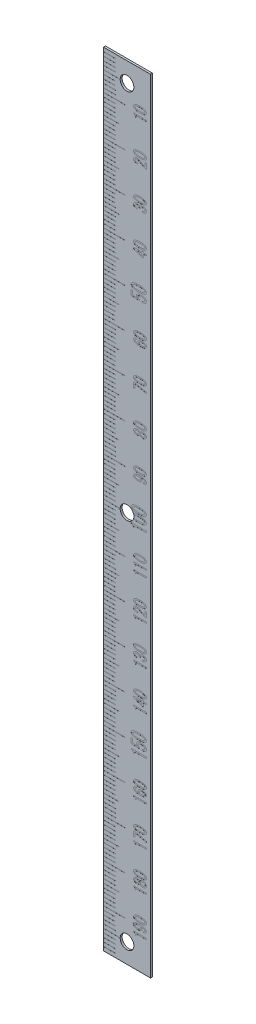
SolidWorks part; units mm, degrees
ref_plane "Front" through (0, 0, 0) normal (0, 0, 1) x (1, 0, 0)
ref_plane "Top" through (0, 0, 0) normal (0, 1, 0) x (1, 0, 0)
ref_plane "Right" through (0, 0, 0) normal (1, 0, 0) x (0, 0, -1)
sketch "Sketch1" plane through (0, 0, 0) normal (0, 0, 1) x (1, 0, 0)
  line L1 (0, 0) -> (0, 200)
  line L2 (0, 0) -> (12, 0)
  line L3 (12, 0) -> (12, 200)
  line L4 (0, 200) -> (12, 200)
  dimension "D1" = 200
  dimension "D2" = 12
extrude "Extrude1" add sketch "Sketch1" along normal blind 0.5
sketch "Sketch2" plane through (0, 0, 0.5) normal (0, 0, 1) x (1, 0, 0)
  line L0 (0, 200) -> (0, 0) construction
  line L1 (0, 0) -> (12, 0) construction
  line L2 (12, 200) -> (0, 200) construction
  circle A0 centre (6, 5) radius 1.75
  circle A1 centre (6, 195) radius 1.75
  circle A4 centre (6, 100) radius 1.75
  dimension "D1" = 6
  dimension "D2" = 6
  dimension "D3" = 5
  dimension "D4" = 5
  dimension "D5" = 3.5
  dimension "D6" = 3.5
  dimension "D8" = 2
extrude "Extrude2" cut sketch "Sketch2" against normal through all
sketch "Sketch3" plane through (0, 0, 0.5) normal (0, 0, 1) x (1, 0, 0)
  line L0 (12, 200) -> (0, 200) construction
  line L1 (7.5, 188.25) -> (11, 188.25) construction
  line L2 (7.5, 188.25) -> (7.5, 191.75) construction
  line L3 (7.5, 191.75) -> (11, 191.75) construction
  line L4 (11, 188.25) -> (11, 191.75) construction
  line L6 (11, 178.25) -> (11, 181.75) construction
  line L7 (11, 168.25) -> (11, 171.75) construction
  line L8 (11, 158.25) -> (11, 161.75) construction
  line L9 (11, 148.25) -> (11, 151.75) construction
  line L10 (11, 138.25) -> (11, 141.75) construction
  line L11 (11, 128.25) -> (11, 131.75) construction
  line L12 (11, 118.25) -> (11, 121.75) construction
  line L13 (11, 108.25) -> (11, 111.75) construction
  line L14 (11, 47.2) -> (11, 52.8) construction
  line L15 (11, 37.2) -> (11, 42.8) construction
  line L16 (11, 98.25) -> (11, 101.75) construction
  line L17 (11, 50) -> (-4.9003, 50) construction
  line L18 (11, 27.2) -> (11, 32.8) construction
  line L19 (11, 17.2) -> (11, 22.8) construction
  line L20 (11, 7.2) -> (11, 12.8) construction
  line L21 (11, 97.2) -> (11, 102.8) construction
  line L22 (12, 0) -> (12, 200) construction
  line L23 (11, 87.2) -> (11, 92.8) construction
  line L24 (11, 57.2) -> (11, 62.8) construction
  line L25 (11, 67.2) -> (11, 72.8) construction
  line L26 (11, 77.2) -> (11, 82.8) construction
  text T0 "10" font "ＭＳ ゴシック" height in points 11
  text T1 "20" font "ＭＳ ゴシック" height in points 11
  text T2 "30" font "ＭＳ ゴシック" height in points 11
  text T3 "40" font "ＭＳ ゴシック" height in points 11
  text T4 "50" font "ＭＳ ゴシック" height in points 13
  text T5 "60  " font "ＭＳ ゴシック" height in points 11
  text T6 "70" font "ＭＳ ゴシック" height in points 11
  text T7 "80" font "ＭＳ ゴシック" height in points 11
  text T8 "90" font "ＭＳ ゴシック" height in points 11
  text T9 "150" font "ＭＳ ゴシック" height in points 13
  text T10 "160" font "ＭＳ ゴシック" height in points 11
  text T11 "170" font "ＭＳ ゴシック" height in points 11
  text T12 "180" font "ＭＳ ゴシック" height in points 11
  text T13 "190" font "ＭＳ ゴシック" height in points 11
  text T14 "100" font "ＭＳ ゴシック" height in points 13
  text T15 "110" font "ＭＳ ゴシック" height in points 11
  text T16 "120" font "ＭＳ ゴシック" height in points 11
  text T17 "130" font "ＭＳ ゴシック" height in points 11
  text T18 "140" font "ＭＳ ゴシック" height in points 11
  point P4 (11, 190)
  dimension "D1" = 3.5
  dimension "D2" = 10
  dimension "D3" = 1
  dimension "D4" = 3.5
  dimension "D8" = 5.6
  dimension "D5" = 4
  dimension "D6" = 7
  dimension "D7" = 5
  dimension "D9" = 2
  dimension "D11" = 2
extrude "Extrude3" cut sketch "Sketch3" against normal blind 0.01
sketch "Sketch4" plane through (0, 0, 0.5) normal (0, 0, 1) x (1, 0, 0)
  line L5 (12, 200) -> (0, 200) construction
  line L806 (6, 200) -> (6, 0) construction
  line L807 (0, 0) -> (12, 0) construction
  line L808 (3, 1.05) -> (3, 0.95)
  line L809 (0, 0.95) -> (3, 0.95)
  line L810 (0, 1.05) -> (3, 1.05)
  line L811 (0, 1.05) -> (0, 0.95)
  line L812 (3, 2.05) -> (3, 1.95)
  line L813 (0, 1.95) -> (3, 1.95)
  line L814 (0, 2.05) -> (3, 2.05)
  line L815 (0, 2.05) -> (0, 1.95)
  line L816 (3, 3.05) -> (3, 2.95)
  line L817 (0, 2.95) -> (3, 2.95)
  line L818 (0, 3.05) -> (3, 3.05)
  line L819 (0, 3.05) -> (0, 2.95)
  line L820 (3, 4.05) -> (3, 3.95)
  line L821 (0, 3.95) -> (3, 3.95)
  line L822 (0, 4.05) -> (3, 4.05)
  line L823 (0, 4.05) -> (0, 3.95)
  line L824 (3, 6.05) -> (3, 5.95)
  line L825 (0, 5.95) -> (3, 5.95)
  line L826 (0, 6.05) -> (3, 6.05)
  line L827 (0, 6.05) -> (0, 5.95)
  line L828 (3, 7.05) -> (3, 6.95)
  line L829 (0, 6.95) -> (3, 6.95)
  line L830 (0, 7.05) -> (3, 7.05)
  line L831 (0, 7.05) -> (0, 6.95)
  line L832 (3, 8.05) -> (3, 7.95)
  line L833 (0, 7.95) -> (3, 7.95)
  line L834 (0, 8.05) -> (3, 8.05)
  line L835 (3, 9.05) -> (3, 8.95)
  line L836 (0, 8.95) -> (3, 8.95)
  line L837 (0, 9.05) -> (0, 8.95)
  line L838 (0, 9.05) -> (3, 9.05)
  line L839 (4, 4.95) -> (4, 5.05)
  line L840 (0, 5.05) -> (4, 5.05)
  line L841 (0, 4.95) -> (0, 5.05)
  line L842 (0, 4.95) -> (4, 4.95)
  line L843 (0, 8.05) -> (0, 7.95)
  line L844 (0, 9.95) -> (0, 10.05)
  line L845 (5.5, 9.95) -> (0, 9.95)
  line L846 (5.5, 10.05) -> (5.5, 9.95)
  line L847 (0, 10.05) -> (5.5, 10.05)
  line L848 (3, 11.05) -> (3, 10.95)
  line L849 (0, 10.95) -> (3, 10.95)
  line L850 (0, 11.05) -> (3, 11.05)
  line L851 (0, 11.05) -> (0, 10.95)
  line L852 (3, 12.05) -> (3, 11.95)
  line L853 (0, 11.95) -> (3, 11.95)
  line L854 (0, 12.05) -> (3, 12.05)
  line L855 (0, 12.05) -> (0, 11.95)
  line L856 (3, 13.05) -> (3, 12.95)
  line L857 (0, 12.95) -> (3, 12.95)
  line L858 (0, 13.05) -> (3, 13.05)
  line L859 (0, 13.05) -> (0, 12.95)
  line L860 (3, 14.05) -> (3, 13.95)
  line L861 (0, 13.95) -> (3, 13.95)
  line L862 (0, 14.05) -> (3, 14.05)
  line L863 (0, 14.05) -> (0, 13.95)
  line L864 (3, 16.05) -> (3, 15.95)
  line L865 (0, 15.95) -> (3, 15.95)
  line L866 (0, 16.05) -> (3, 16.05)
  line L867 (0, 16.05) -> (0, 15.95)
  line L868 (3, 17.05) -> (3, 16.95)
  line L869 (0, 16.95) -> (3, 16.95)
  line L870 (0, 17.05) -> (3, 17.05)
  line L871 (0, 17.05) -> (0, 16.95)
  line L872 (3, 18.05) -> (3, 17.95)
  line L873 (0, 17.95) -> (3, 17.95)
  line L874 (0, 18.05) -> (3, 18.05)
  line L875 (3, 19.05) -> (3, 18.95)
  line L876 (0, 18.95) -> (3, 18.95)
  line L877 (0, 19.05) -> (0, 18.95)
  line L878 (0, 19.05) -> (3, 19.05)
  line L879 (4, 14.95) -> (4, 15.05)
  line L880 (0, 15.05) -> (4, 15.05)
  line L881 (0, 14.95) -> (0, 15.05)
  line L882 (0, 14.95) -> (4, 14.95)
  line L883 (0, 18.05) -> (0, 17.95)
  line L884 (0, 19.95) -> (0, 20.05)
  line L885 (5.5, 19.95) -> (0, 19.95)
  line L886 (5.5, 20.05) -> (5.5, 19.95)
  line L887 (0, 20.05) -> (5.5, 20.05)
  line L888 (3, 21.05) -> (3, 20.95)
  line L889 (0, 20.95) -> (3, 20.95)
  line L890 (0, 21.05) -> (3, 21.05)
  line L891 (0, 21.05) -> (0, 20.95)
  line L892 (3, 22.05) -> (3, 21.95)
  line L893 (0, 21.95) -> (3, 21.95)
  line L894 (0, 22.05) -> (3, 22.05)
  line L895 (0, 22.05) -> (0, 21.95)
  line L896 (3, 23.05) -> (3, 22.95)
  line L897 (0, 22.95) -> (3, 22.95)
  line L898 (0, 23.05) -> (3, 23.05)
  line L899 (0, 23.05) -> (0, 22.95)
  line L900 (3, 24.05) -> (3, 23.95)
  line L901 (0, 23.95) -> (3, 23.95)
  line L902 (0, 24.05) -> (3, 24.05)
  line L903 (0, 24.05) -> (0, 23.95)
  line L904 (3, 26.05) -> (3, 25.95)
  line L905 (0, 25.95) -> (3, 25.95)
  line L906 (0, 26.05) -> (3, 26.05)
  line L907 (0, 26.05) -> (0, 25.95)
  line L908 (3, 27.05) -> (3, 26.95)
  line L909 (0, 26.95) -> (3, 26.95)
  line L910 (0, 27.05) -> (3, 27.05)
  line L911 (0, 27.05) -> (0, 26.95)
  line L912 (3, 28.05) -> (3, 27.95)
  line L913 (0, 27.95) -> (3, 27.95)
  line L914 (0, 28.05) -> (3, 28.05)
  line L915 (3, 29.05) -> (3, 28.95)
  line L916 (0, 28.95) -> (3, 28.95)
  line L917 (0, 29.05) -> (0, 28.95)
  line L918 (0, 29.05) -> (3, 29.05)
  line L919 (4, 24.95) -> (4, 25.05)
  line L920 (0, 25.05) -> (4, 25.05)
  line L921 (0, 24.95) -> (0, 25.05)
  line L922 (0, 24.95) -> (4, 24.95)
  line L923 (0, 28.05) -> (0, 27.95)
  line L924 (0, 29.95) -> (0, 30.05)
  line L925 (5.5, 29.95) -> (0, 29.95)
  line L926 (5.5, 30.05) -> (5.5, 29.95)
  line L927 (0, 30.05) -> (5.5, 30.05)
  line L928 (3, 31.05) -> (3, 30.95)
  line L929 (0, 30.95) -> (3, 30.95)
  line L930 (0, 31.05) -> (3, 31.05)
  line L931 (0, 31.05) -> (0, 30.95)
  line L932 (3, 32.05) -> (3, 31.95)
  line L933 (0, 31.95) -> (3, 31.95)
  line L934 (0, 32.05) -> (3, 32.05)
  line L935 (0, 32.05) -> (0, 31.95)
  line L936 (3, 33.05) -> (3, 32.95)
  line L937 (0, 32.95) -> (3, 32.95)
  line L938 (0, 33.05) -> (3, 33.05)
  line L939 (0, 33.05) -> (0, 32.95)
  line L940 (3, 34.05) -> (3, 33.95)
  line L941 (0, 33.95) -> (3, 33.95)
  line L942 (0, 34.05) -> (3, 34.05)
  line L943 (0, 34.05) -> (0, 33.95)
  line L944 (3, 36.05) -> (3, 35.95)
  line L945 (0, 35.95) -> (3, 35.95)
  line L946 (0, 36.05) -> (3, 36.05)
  line L947 (0, 36.05) -> (0, 35.95)
  line L948 (3, 37.05) -> (3, 36.95)
  line L949 (0, 36.95) -> (3, 36.95)
  line L950 (0, 37.05) -> (3, 37.05)
  line L951 (0, 37.05) -> (0, 36.95)
  line L952 (3, 38.05) -> (3, 37.95)
  line L953 (0, 37.95) -> (3, 37.95)
  line L954 (0, 38.05) -> (3, 38.05)
  line L955 (3, 39.05) -> (3, 38.95)
  line L956 (0, 38.95) -> (3, 38.95)
  line L957 (0, 39.05) -> (0, 38.95)
  line L958 (0, 39.05) -> (3, 39.05)
  line L959 (4, 34.95) -> (4, 35.05)
  line L960 (0, 35.05) -> (4, 35.05)
  line L961 (0, 34.95) -> (0, 35.05)
  line L962 (0, 34.95) -> (4, 34.95)
  line L963 (0, 38.05) -> (0, 37.95)
  line L964 (0, 39.95) -> (0, 40.05)
  line L965 (5.5, 39.95) -> (0, 39.95)
  line L966 (5.5, 40.05) -> (5.5, 39.95)
  line L967 (0, 40.05) -> (5.5, 40.05)
  line L968 (3, 41.05) -> (3, 40.95)
  line L969 (0, 40.95) -> (3, 40.95)
  line L970 (0, 41.05) -> (3, 41.05)
  line L971 (0, 41.05) -> (0, 40.95)
  line L972 (3, 42.05) -> (3, 41.95)
  line L973 (0, 41.95) -> (3, 41.95)
  line L974 (0, 42.05) -> (3, 42.05)
  line L975 (0, 42.05) -> (0, 41.95)
  line L976 (3, 43.05) -> (3, 42.95)
  line L977 (0, 42.95) -> (3, 42.95)
  line L978 (0, 43.05) -> (3, 43.05)
  line L979 (0, 43.05) -> (0, 42.95)
  line L980 (3, 44.05) -> (3, 43.95)
  line L981 (0, 43.95) -> (3, 43.95)
  line L982 (0, 44.05) -> (3, 44.05)
  line L983 (0, 44.05) -> (0, 43.95)
  line L984 (3, 46.05) -> (3, 45.95)
  line L985 (0, 45.95) -> (3, 45.95)
  line L986 (0, 46.05) -> (3, 46.05)
  line L987 (0, 46.05) -> (0, 45.95)
  line L988 (3, 47.05) -> (3, 46.95)
  line L989 (0, 46.95) -> (3, 46.95)
  line L990 (0, 47.05) -> (3, 47.05)
  line L991 (0, 47.05) -> (0, 46.95)
  line L992 (3, 48.05) -> (3, 47.95)
  line L993 (0, 47.95) -> (3, 47.95)
  line L994 (0, 48.05) -> (3, 48.05)
  line L995 (3, 49.05) -> (3, 48.95)
  line L996 (0, 48.95) -> (3, 48.95)
  line L997 (0, 49.05) -> (0, 48.95)
  line L998 (0, 49.05) -> (3, 49.05)
  line L999 (4, 44.95) -> (4, 45.05)
  line L1000 (0, 45.05) -> (4, 45.05)
  line L1001 (0, 44.95) -> (0, 45.05)
  line L1002 (0, 44.95) -> (4, 44.95)
  line L1003 (0, 48.05) -> (0, 47.95)
  line L1004 (0, 49.95) -> (0, 50.05)
  line L1005 (5.5, 49.95) -> (0, 49.95)
  line L1006 (5.5, 50.05) -> (5.5, 49.95)
  line L1007 (0, 50.05) -> (5.5, 50.05)
  line L1008 (3, 51.05) -> (3, 50.95)
  line L1009 (0, 50.95) -> (3, 50.95)
  line L1010 (0, 51.05) -> (3, 51.05)
  line L1011 (0, 51.05) -> (0, 50.95)
  line L1012 (3, 52.05) -> (3, 51.95)
  line L1013 (0, 51.95) -> (3, 51.95)
  line L1014 (0, 52.05) -> (3, 52.05)
  line L1015 (0, 52.05) -> (0, 51.95)
  line L1016 (3, 53.05) -> (3, 52.95)
  line L1017 (0, 52.95) -> (3, 52.95)
  line L1018 (0, 53.05) -> (3, 53.05)
  line L1019 (0, 53.05) -> (0, 52.95)
  line L1020 (3, 54.05) -> (3, 53.95)
  line L1021 (0, 53.95) -> (3, 53.95)
  line L1022 (0, 54.05) -> (3, 54.05)
  line L1023 (0, 54.05) -> (0, 53.95)
  line L1024 (3, 56.05) -> (3, 55.95)
  line L1025 (0, 55.95) -> (3, 55.95)
  line L1026 (0, 56.05) -> (3, 56.05)
  line L1027 (0, 56.05) -> (0, 55.95)
  line L1028 (3, 57.05) -> (3, 56.95)
  line L1029 (0, 56.95) -> (3, 56.95)
  line L1030 (0, 57.05) -> (3, 57.05)
  line L1031 (0, 57.05) -> (0, 56.95)
  line L1032 (3, 58.05) -> (3, 57.95)
  line L1033 (0, 57.95) -> (3, 57.95)
  line L1034 (0, 58.05) -> (3, 58.05)
  line L1035 (3, 59.05) -> (3, 58.95)
  line L1036 (0, 58.95) -> (3, 58.95)
  line L1037 (0, 59.05) -> (0, 58.95)
  line L1038 (0, 59.05) -> (3, 59.05)
  line L1039 (4, 54.95) -> (4, 55.05)
  line L1040 (0, 55.05) -> (4, 55.05)
  line L1041 (0, 54.95) -> (0, 55.05)
  line L1042 (0, 54.95) -> (4, 54.95)
  line L1043 (0, 58.05) -> (0, 57.95)
  line L1044 (0, 59.95) -> (0, 60.05)
  line L1045 (5.5, 59.95) -> (0, 59.95)
  line L1046 (5.5, 60.05) -> (5.5, 59.95)
  line L1047 (0, 60.05) -> (5.5, 60.05)
  line L1048 (3, 61.05) -> (3, 60.95)
  line L1049 (0, 60.95) -> (3, 60.95)
  line L1050 (0, 61.05) -> (3, 61.05)
  line L1051 (0, 61.05) -> (0, 60.95)
  line L1052 (3, 62.05) -> (3, 61.95)
  line L1053 (0, 61.95) -> (3, 61.95)
  line L1054 (0, 62.05) -> (3, 62.05)
  line L1055 (0, 62.05) -> (0, 61.95)
  line L1056 (3, 63.05) -> (3, 62.95)
  line L1057 (0, 62.95) -> (3, 62.95)
  line L1058 (0, 63.05) -> (3, 63.05)
  line L1059 (0, 63.05) -> (0, 62.95)
  line L1060 (3, 64.05) -> (3, 63.95)
  line L1061 (0, 63.95) -> (3, 63.95)
  line L1062 (0, 64.05) -> (3, 64.05)
  line L1063 (0, 64.05) -> (0, 63.95)
  line L1064 (3, 66.05) -> (3, 65.95)
  line L1065 (0, 65.95) -> (3, 65.95)
  line L1066 (0, 66.05) -> (3, 66.05)
  line L1067 (0, 66.05) -> (0, 65.95)
  line L1068 (3, 67.05) -> (3, 66.95)
  line L1069 (0, 66.95) -> (3, 66.95)
  line L1070 (0, 67.05) -> (3, 67.05)
  line L1071 (0, 67.05) -> (0, 66.95)
  line L1072 (3, 68.05) -> (3, 67.95)
  line L1073 (0, 67.95) -> (3, 67.95)
  line L1074 (0, 68.05) -> (3, 68.05)
  line L1075 (3, 69.05) -> (3, 68.95)
  line L1076 (0, 68.95) -> (3, 68.95)
  line L1077 (0, 69.05) -> (0, 68.95)
  line L1078 (0, 69.05) -> (3, 69.05)
  line L1079 (4, 64.95) -> (4, 65.05)
  line L1080 (0, 65.05) -> (4, 65.05)
  line L1081 (0, 64.95) -> (0, 65.05)
  line L1082 (0, 64.95) -> (4, 64.95)
  line L1083 (0, 68.05) -> (0, 67.95)
  line L1084 (0, 69.95) -> (0, 70.05)
  line L1085 (5.5, 69.95) -> (0, 69.95)
  line L1086 (5.5, 70.05) -> (5.5, 69.95)
  line L1087 (0, 70.05) -> (5.5, 70.05)
  line L1088 (3, 71.05) -> (3, 70.95)
  line L1089 (0, 70.95) -> (3, 70.95)
  line L1090 (0, 71.05) -> (3, 71.05)
  line L1091 (0, 71.05) -> (0, 70.95)
  line L1092 (3, 72.05) -> (3, 71.95)
  line L1093 (0, 71.95) -> (3, 71.95)
  line L1094 (0, 72.05) -> (3, 72.05)
  line L1095 (0, 72.05) -> (0, 71.95)
  line L1096 (3, 73.05) -> (3, 72.95)
  line L1097 (0, 72.95) -> (3, 72.95)
  line L1098 (0, 73.05) -> (3, 73.05)
  line L1099 (0, 73.05) -> (0, 72.95)
  line L1100 (3, 74.05) -> (3, 73.95)
  line L1101 (0, 73.95) -> (3, 73.95)
  line L1102 (0, 74.05) -> (3, 74.05)
  line L1103 (0, 74.05) -> (0, 73.95)
  line L1104 (3, 76.05) -> (3, 75.95)
  line L1105 (0, 75.95) -> (3, 75.95)
  line L1106 (0, 76.05) -> (3, 76.05)
  line L1107 (0, 76.05) -> (0, 75.95)
  line L1108 (3, 77.05) -> (3, 76.95)
  line L1109 (0, 76.95) -> (3, 76.95)
  line L1110 (0, 77.05) -> (3, 77.05)
  line L1111 (0, 77.05) -> (0, 76.95)
  line L1112 (3, 78.05) -> (3, 77.95)
  line L1113 (0, 77.95) -> (3, 77.95)
  line L1114 (0, 78.05) -> (3, 78.05)
  line L1115 (3, 79.05) -> (3, 78.95)
  line L1116 (0, 78.95) -> (3, 78.95)
  line L1117 (0, 79.05) -> (0, 78.95)
  line L1118 (0, 79.05) -> (3, 79.05)
  line L1119 (4, 74.95) -> (4, 75.05)
  line L1120 (0, 75.05) -> (4, 75.05)
  line L1121 (0, 74.95) -> (0, 75.05)
  line L1122 (0, 74.95) -> (4, 74.95)
  line L1123 (0, 78.05) -> (0, 77.95)
  line L1124 (0, 79.95) -> (0, 80.05)
  line L1125 (5.5, 79.95) -> (0, 79.95)
  line L1126 (5.5, 80.05) -> (5.5, 79.95)
  line L1127 (0, 80.05) -> (5.5, 80.05)
  line L1128 (3, 81.05) -> (3, 80.95)
  line L1129 (0, 80.95) -> (3, 80.95)
  line L1130 (0, 81.05) -> (3, 81.05)
  line L1131 (0, 81.05) -> (0, 80.95)
  line L1132 (3, 82.05) -> (3, 81.95)
  line L1133 (0, 81.95) -> (3, 81.95)
  line L1134 (0, 82.05) -> (3, 82.05)
  line L1135 (0, 82.05) -> (0, 81.95)
  line L1136 (3, 83.05) -> (3, 82.95)
  line L1137 (0, 82.95) -> (3, 82.95)
  line L1138 (0, 83.05) -> (3, 83.05)
  line L1139 (0, 83.05) -> (0, 82.95)
  line L1140 (3, 84.05) -> (3, 83.95)
  line L1141 (0, 83.95) -> (3, 83.95)
  line L1142 (0, 84.05) -> (3, 84.05)
  line L1143 (0, 84.05) -> (0, 83.95)
  line L1144 (3, 86.05) -> (3, 85.95)
  line L1145 (0, 85.95) -> (3, 85.95)
  line L1146 (0, 86.05) -> (3, 86.05)
  line L1147 (0, 86.05) -> (0, 85.95)
  line L1148 (3, 87.05) -> (3, 86.95)
  line L1149 (0, 86.95) -> (3, 86.95)
  line L1150 (0, 87.05) -> (3, 87.05)
  line L1151 (0, 87.05) -> (0, 86.95)
  line L1152 (3, 88.05) -> (3, 87.95)
  line L1153 (0, 87.95) -> (3, 87.95)
  line L1154 (0, 88.05) -> (3, 88.05)
  line L1155 (3, 89.05) -> (3, 88.95)
  line L1156 (0, 88.95) -> (3, 88.95)
  line L1157 (0, 89.05) -> (0, 88.95)
  line L1158 (0, 89.05) -> (3, 89.05)
  line L1159 (4, 84.95) -> (4, 85.05)
  line L1160 (0, 85.05) -> (4, 85.05)
  line L1161 (0, 84.95) -> (0, 85.05)
  line L1162 (0, 84.95) -> (4, 84.95)
  line L1163 (0, 88.05) -> (0, 87.95)
  line L1164 (0, 89.95) -> (0, 90.05)
  line L1165 (5.5, 89.95) -> (0, 89.95)
  line L1166 (5.5, 90.05) -> (5.5, 89.95)
  line L1167 (0, 90.05) -> (5.5, 90.05)
  line L1168 (3, 91.05) -> (3, 90.95)
  line L1169 (0, 90.95) -> (3, 90.95)
  line L1170 (0, 91.05) -> (3, 91.05)
  line L1171 (0, 91.05) -> (0, 90.95)
  line L1172 (3, 92.05) -> (3, 91.95)
  line L1173 (0, 91.95) -> (3, 91.95)
  line L1174 (0, 92.05) -> (3, 92.05)
  line L1175 (0, 92.05) -> (0, 91.95)
  line L1176 (3, 93.05) -> (3, 92.95)
  line L1177 (0, 92.95) -> (3, 92.95)
  line L1178 (0, 93.05) -> (3, 93.05)
  line L1179 (0, 93.05) -> (0, 92.95)
  line L1180 (3, 94.05) -> (3, 93.95)
  line L1181 (0, 93.95) -> (3, 93.95)
  line L1182 (0, 94.05) -> (3, 94.05)
  line L1183 (0, 94.05) -> (0, 93.95)
  line L1184 (3, 96.05) -> (3, 95.95)
  line L1185 (0, 95.95) -> (3, 95.95)
  line L1186 (0, 96.05) -> (3, 96.05)
  line L1187 (0, 96.05) -> (0, 95.95)
  line L1188 (3, 97.05) -> (3, 96.95)
  line L1189 (0, 96.95) -> (3, 96.95)
  line L1190 (0, 97.05) -> (3, 97.05)
  line L1191 (0, 97.05) -> (0, 96.95)
  line L1192 (3, 98.05) -> (3, 97.95)
  line L1193 (0, 97.95) -> (3, 97.95)
  line L1194 (0, 98.05) -> (3, 98.05)
  line L1195 (3, 99.05) -> (3, 98.95)
  line L1196 (0, 98.95) -> (3, 98.95)
  line L1197 (0, 99.05) -> (0, 98.95)
  line L1198 (0, 99.05) -> (3, 99.05)
  line L1199 (4, 94.95) -> (4, 95.05)
  line L1200 (0, 95.05) -> (4, 95.05)
  line L1201 (0, 94.95) -> (0, 95.05)
  line L1202 (0, 94.95) -> (4, 94.95)
  line L1203 (0, 98.05) -> (0, 97.95)
  line L1204 (0, 99.95) -> (0, 100.05)
  line L1205 (5.5, 99.95) -> (0, 99.95)
  line L1206 (5.5, 100.05) -> (5.5, 99.95)
  line L1207 (0, 100.05) -> (5.5, 100.05)
  line L1208 (3, 101.05) -> (3, 100.95)
  line L1209 (0, 100.95) -> (3, 100.95)
  line L1210 (0, 101.05) -> (3, 101.05)
  line L1211 (0, 101.05) -> (0, 100.95)
  line L1212 (3, 102.05) -> (3, 101.95)
  line L1213 (0, 101.95) -> (3, 101.95)
  line L1214 (0, 102.05) -> (3, 102.05)
  line L1215 (0, 102.05) -> (0, 101.95)
  line L1216 (3, 103.05) -> (3, 102.95)
  line L1217 (0, 102.95) -> (3, 102.95)
  line L1218 (0, 103.05) -> (3, 103.05)
  line L1219 (0, 103.05) -> (0, 102.95)
  line L1220 (3, 104.05) -> (3, 103.95)
  line L1221 (0, 103.95) -> (3, 103.95)
  line L1222 (0, 104.05) -> (3, 104.05)
  line L1223 (0, 104.05) -> (0, 103.95)
  line L1224 (3, 106.05) -> (3, 105.95)
  line L1225 (0, 105.95) -> (3, 105.95)
  line L1226 (0, 106.05) -> (3, 106.05)
  line L1227 (0, 106.05) -> (0, 105.95)
  line L1228 (3, 107.05) -> (3, 106.95)
  line L1229 (0, 106.95) -> (3, 106.95)
  line L1230 (0, 107.05) -> (3, 107.05)
  line L1231 (0, 107.05) -> (0, 106.95)
  line L1232 (3, 108.05) -> (3, 107.95)
  line L1233 (0, 107.95) -> (3, 107.95)
  line L1234 (0, 108.05) -> (3, 108.05)
  line L1235 (3, 109.05) -> (3, 108.95)
  line L1236 (0, 108.95) -> (3, 108.95)
  line L1237 (0, 109.05) -> (0, 108.95)
  line L1238 (0, 109.05) -> (3, 109.05)
  line L1239 (4, 104.95) -> (4, 105.05)
  line L1240 (0, 105.05) -> (4, 105.05)
  line L1241 (0, 104.95) -> (0, 105.05)
  line L1242 (0, 104.95) -> (4, 104.95)
  line L1243 (0, 108.05) -> (0, 107.95)
  line L1244 (0, 109.95) -> (0, 110.05)
  line L1245 (5.5, 109.95) -> (0, 109.95)
  line L1246 (5.5, 110.05) -> (5.5, 109.95)
  line L1247 (0, 110.05) -> (5.5, 110.05)
  line L1248 (3, 111.05) -> (3, 110.95)
  line L1249 (0, 110.95) -> (3, 110.95)
  line L1250 (0, 111.05) -> (3, 111.05)
  line L1251 (0, 111.05) -> (0, 110.95)
  line L1252 (3, 112.05) -> (3, 111.95)
  line L1253 (0, 111.95) -> (3, 111.95)
  line L1254 (0, 112.05) -> (3, 112.05)
  line L1255 (0, 112.05) -> (0, 111.95)
  line L1256 (3, 113.05) -> (3, 112.95)
  line L1257 (0, 112.95) -> (3, 112.95)
  line L1258 (0, 113.05) -> (3, 113.05)
  line L1259 (0, 113.05) -> (0, 112.95)
  line L1260 (3, 114.05) -> (3, 113.95)
  line L1261 (0, 113.95) -> (3, 113.95)
  line L1262 (0, 114.05) -> (3, 114.05)
  line L1263 (0, 114.05) -> (0, 113.95)
  line L1264 (3, 116.05) -> (3, 115.95)
  line L1265 (0, 115.95) -> (3, 115.95)
  line L1266 (0, 116.05) -> (3, 116.05)
  line L1267 (0, 116.05) -> (0, 115.95)
  line L1268 (3, 117.05) -> (3, 116.95)
  line L1269 (0, 116.95) -> (3, 116.95)
  line L1270 (0, 117.05) -> (3, 117.05)
  line L1271 (0, 117.05) -> (0, 116.95)
  line L1272 (3, 118.05) -> (3, 117.95)
  line L1273 (0, 117.95) -> (3, 117.95)
  line L1274 (0, 118.05) -> (3, 118.05)
  line L1275 (3, 119.05) -> (3, 118.95)
  line L1276 (0, 118.95) -> (3, 118.95)
  line L1277 (0, 119.05) -> (0, 118.95)
  line L1278 (0, 119.05) -> (3, 119.05)
  line L1279 (4, 114.95) -> (4, 115.05)
  line L1280 (0, 115.05) -> (4, 115.05)
  line L1281 (0, 114.95) -> (0, 115.05)
  line L1282 (0, 114.95) -> (4, 114.95)
  line L1283 (0, 118.05) -> (0, 117.95)
  line L1284 (0, 119.95) -> (0, 120.05)
  line L1285 (5.5, 119.95) -> (0, 119.95)
  line L1286 (5.5, 120.05) -> (5.5, 119.95)
  line L1287 (0, 120.05) -> (5.5, 120.05)
  line L1288 (3, 121.05) -> (3, 120.95)
  line L1289 (0, 120.95) -> (3, 120.95)
  line L1290 (0, 121.05) -> (3, 121.05)
  line L1291 (0, 121.05) -> (0, 120.95)
  line L1292 (3, 122.05) -> (3, 121.95)
  line L1293 (0, 121.95) -> (3, 121.95)
  line L1294 (0, 122.05) -> (3, 122.05)
  line L1295 (0, 122.05) -> (0, 121.95)
  line L1296 (3, 123.05) -> (3, 122.95)
  line L1297 (0, 122.95) -> (3, 122.95)
  line L1298 (0, 123.05) -> (3, 123.05)
  line L1299 (0, 123.05) -> (0, 122.95)
  line L1300 (3, 124.05) -> (3, 123.95)
  line L1301 (0, 123.95) -> (3, 123.95)
  line L1302 (0, 124.05) -> (3, 124.05)
  line L1303 (0, 124.05) -> (0, 123.95)
  line L1304 (3, 126.05) -> (3, 125.95)
  line L1305 (0, 125.95) -> (3, 125.95)
  line L1306 (0, 126.05) -> (3, 126.05)
  line L1307 (0, 126.05) -> (0, 125.95)
  line L1308 (3, 127.05) -> (3, 126.95)
  line L1309 (0, 126.95) -> (3, 126.95)
  line L1310 (0, 127.05) -> (3, 127.05)
  line L1311 (0, 127.05) -> (0, 126.95)
  line L1312 (3, 128.05) -> (3, 127.95)
  line L1313 (0, 127.95) -> (3, 127.95)
  line L1314 (0, 128.05) -> (3, 128.05)
  line L1315 (3, 129.05) -> (3, 128.95)
  line L1316 (0, 128.95) -> (3, 128.95)
  line L1317 (0, 129.05) -> (0, 128.95)
  line L1318 (0, 129.05) -> (3, 129.05)
  line L1319 (4, 124.95) -> (4, 125.05)
  line L1320 (0, 125.05) -> (4, 125.05)
  line L1321 (0, 124.95) -> (0, 125.05)
  line L1322 (0, 124.95) -> (4, 124.95)
  line L1323 (0, 128.05) -> (0, 127.95)
  line L1324 (0, 129.95) -> (0, 130.05)
  line L1325 (5.5, 129.95) -> (0, 129.95)
  line L1326 (5.5, 130.05) -> (5.5, 129.95)
  line L1327 (0, 130.05) -> (5.5, 130.05)
  line L1328 (3, 131.05) -> (3, 130.95)
  line L1329 (0, 130.95) -> (3, 130.95)
  line L1330 (0, 131.05) -> (3, 131.05)
  line L1331 (0, 131.05) -> (0, 130.95)
  line L1332 (3, 132.05) -> (3, 131.95)
  line L1333 (0, 131.95) -> (3, 131.95)
  line L1334 (0, 132.05) -> (3, 132.05)
  line L1335 (0, 132.05) -> (0, 131.95)
  line L1336 (3, 133.05) -> (3, 132.95)
  line L1337 (0, 132.95) -> (3, 132.95)
  line L1338 (0, 133.05) -> (3, 133.05)
  line L1339 (0, 133.05) -> (0, 132.95)
  line L1340 (3, 134.05) -> (3, 133.95)
  line L1341 (0, 133.95) -> (3, 133.95)
  line L1342 (0, 134.05) -> (3, 134.05)
  line L1343 (0, 134.05) -> (0, 133.95)
  line L1344 (3, 136.05) -> (3, 135.95)
  line L1345 (0, 135.95) -> (3, 135.95)
  line L1346 (0, 136.05) -> (3, 136.05)
  line L1347 (0, 136.05) -> (0, 135.95)
  line L1348 (3, 137.05) -> (3, 136.95)
  line L1349 (0, 136.95) -> (3, 136.95)
  line L1350 (0, 137.05) -> (3, 137.05)
  line L1351 (0, 137.05) -> (0, 136.95)
  line L1352 (3, 138.05) -> (3, 137.95)
  line L1353 (0, 137.95) -> (3, 137.95)
  line L1354 (0, 138.05) -> (3, 138.05)
  line L1355 (3, 139.05) -> (3, 138.95)
  line L1356 (0, 138.95) -> (3, 138.95)
  line L1357 (0, 139.05) -> (0, 138.95)
  line L1358 (0, 139.05) -> (3, 139.05)
  line L1359 (4, 134.95) -> (4, 135.05)
  line L1360 (0, 135.05) -> (4, 135.05)
  line L1361 (0, 134.95) -> (0, 135.05)
  line L1362 (0, 134.95) -> (4, 134.95)
  line L1363 (0, 138.05) -> (0, 137.95)
  line L1364 (0, 139.95) -> (0, 140.05)
  line L1365 (5.5, 139.95) -> (0, 139.95)
  line L1366 (5.5, 140.05) -> (5.5, 139.95)
  line L1367 (0, 140.05) -> (5.5, 140.05)
  line L1368 (3, 141.05) -> (3, 140.95)
  line L1369 (0, 140.95) -> (3, 140.95)
  line L1370 (0, 141.05) -> (3, 141.05)
  line L1371 (0, 141.05) -> (0, 140.95)
  line L1372 (3, 142.05) -> (3, 141.95)
  line L1373 (0, 141.95) -> (3, 141.95)
  line L1374 (0, 142.05) -> (3, 142.05)
  line L1375 (0, 142.05) -> (0, 141.95)
  line L1376 (3, 143.05) -> (3, 142.95)
  line L1377 (0, 142.95) -> (3, 142.95)
  line L1378 (0, 143.05) -> (3, 143.05)
  line L1379 (0, 143.05) -> (0, 142.95)
  line L1380 (3, 144.05) -> (3, 143.95)
  line L1381 (0, 143.95) -> (3, 143.95)
  line L1382 (0, 144.05) -> (3, 144.05)
  line L1383 (0, 144.05) -> (0, 143.95)
  line L1384 (3, 146.05) -> (3, 145.95)
  line L1385 (0, 145.95) -> (3, 145.95)
  line L1386 (0, 146.05) -> (3, 146.05)
  line L1387 (0, 146.05) -> (0, 145.95)
  line L1388 (3, 147.05) -> (3, 146.95)
  line L1389 (0, 146.95) -> (3, 146.95)
  line L1390 (0, 147.05) -> (3, 147.05)
  line L1391 (0, 147.05) -> (0, 146.95)
  line L1392 (3, 148.05) -> (3, 147.95)
  line L1393 (0, 147.95) -> (3, 147.95)
  line L1394 (0, 148.05) -> (3, 148.05)
  line L1395 (3, 149.05) -> (3, 148.95)
  line L1396 (0, 148.95) -> (3, 148.95)
  line L1397 (0, 149.05) -> (0, 148.95)
  line L1398 (0, 149.05) -> (3, 149.05)
  line L1399 (4, 144.95) -> (4, 145.05)
  line L1400 (0, 145.05) -> (4, 145.05)
  line L1401 (0, 144.95) -> (0, 145.05)
  line L1402 (0, 144.95) -> (4, 144.95)
  line L1403 (0, 148.05) -> (0, 147.95)
  line L1404 (3, 151.05) -> (3, 150.95)
  line L1405 (0, 150.95) -> (3, 150.95)
  line L1406 (0, 151.05) -> (3, 151.05)
  line L1407 (0, 151.05) -> (0, 150.95)
  line L1408 (3, 152.05) -> (3, 151.95)
  line L1409 (0, 151.95) -> (3, 151.95)
  line L1410 (0, 152.05) -> (3, 152.05)
  line L1411 (0, 152.05) -> (0, 151.95)
  line L1412 (3, 153.05) -> (3, 152.95)
  line L1413 (0, 152.95) -> (3, 152.95)
  line L1414 (0, 153.05) -> (3, 153.05)
  line L1415 (0, 153.05) -> (0, 152.95)
  line L1416 (3, 154.05) -> (3, 153.95)
  line L1417 (0, 153.95) -> (3, 153.95)
  line L1418 (0, 154.05) -> (3, 154.05)
  line L1419 (0, 154.05) -> (0, 153.95)
  line L1420 (3, 156.05) -> (3, 155.95)
  line L1421 (0, 155.95) -> (3, 155.95)
  line L1422 (0, 156.05) -> (3, 156.05)
  line L1423 (0, 156.05) -> (0, 155.95)
  line L1424 (3, 157.05) -> (3, 156.95)
  line L1425 (0, 156.95) -> (3, 156.95)
  line L1426 (0, 157.05) -> (3, 157.05)
  line L1427 (0, 157.05) -> (0, 156.95)
  line L1428 (3, 158.05) -> (3, 157.95)
  line L1429 (0, 157.95) -> (3, 157.95)
  line L1430 (0, 158.05) -> (3, 158.05)
  line L1431 (3, 159.05) -> (3, 158.95)
  line L1432 (0, 158.95) -> (3, 158.95)
  line L1433 (0, 159.05) -> (0, 158.95)
  line L1434 (0, 159.05) -> (3, 159.05)
  line L1435 (4, 154.95) -> (4, 155.05)
  line L1436 (0, 155.05) -> (4, 155.05)
  line L1437 (0, 154.95) -> (0, 155.05)
  line L1438 (0, 154.95) -> (4, 154.95)
  line L1439 (0, 158.05) -> (0, 157.95)
  line L1440 (0, 149.95) -> (0, 150.05)
  line L1441 (5.5, 149.95) -> (0, 149.95)
  line L1442 (5.5, 150.05) -> (5.5, 149.95)
  line L1443 (0, 150.05) -> (5.5, 150.05)
  line L1444 (3, 161.05) -> (3, 160.95)
  line L1445 (0, 160.95) -> (3, 160.95)
  line L1446 (0, 161.05) -> (3, 161.05)
  line L1447 (0, 161.05) -> (0, 160.95)
  line L1448 (3, 162.05) -> (3, 161.95)
  line L1449 (0, 161.95) -> (3, 161.95)
  line L1450 (0, 162.05) -> (3, 162.05)
  line L1451 (0, 162.05) -> (0, 161.95)
  line L1452 (3, 163.05) -> (3, 162.95)
  line L1453 (0, 162.95) -> (3, 162.95)
  line L1454 (0, 163.05) -> (3, 163.05)
  line L1455 (0, 163.05) -> (0, 162.95)
  line L1456 (3, 164.05) -> (3, 163.95)
  line L1457 (0, 163.95) -> (3, 163.95)
  line L1458 (0, 164.05) -> (3, 164.05)
  line L1459 (0, 164.05) -> (0, 163.95)
  line L1460 (3, 166.05) -> (3, 165.95)
  line L1461 (0, 165.95) -> (3, 165.95)
  line L1462 (0, 166.05) -> (3, 166.05)
  line L1463 (0, 166.05) -> (0, 165.95)
  line L1464 (3, 167.05) -> (3, 166.95)
  line L1465 (0, 166.95) -> (3, 166.95)
  line L1466 (0, 167.05) -> (3, 167.05)
  line L1467 (0, 167.05) -> (0, 166.95)
  line L1468 (3, 168.05) -> (3, 167.95)
  line L1469 (0, 167.95) -> (3, 167.95)
  line L1470 (0, 168.05) -> (3, 168.05)
  line L1471 (3, 169.05) -> (3, 168.95)
  line L1472 (0, 168.95) -> (3, 168.95)
  line L1473 (0, 169.05) -> (0, 168.95)
  line L1474 (0, 169.05) -> (3, 169.05)
  line L1475 (4, 164.95) -> (4, 165.05)
  line L1476 (0, 165.05) -> (4, 165.05)
  line L1477 (0, 164.95) -> (0, 165.05)
  line L1478 (0, 164.95) -> (4, 164.95)
  line L1479 (0, 168.05) -> (0, 167.95)
  line L1480 (0, 159.95) -> (0, 160.05)
  line L1481 (5.5, 159.95) -> (0, 159.95)
  line L1482 (5.5, 160.05) -> (5.5, 159.95)
  line L1483 (0, 160.05) -> (5.5, 160.05)
  line L1484 (3, 171.05) -> (3, 170.95)
  line L1485 (0, 170.95) -> (3, 170.95)
  line L1486 (0, 171.05) -> (3, 171.05)
  line L1487 (0, 171.05) -> (0, 170.95)
  line L1488 (3, 172.05) -> (3, 171.95)
  line L1489 (0, 171.95) -> (3, 171.95)
  line L1490 (0, 172.05) -> (3, 172.05)
  line L1491 (0, 172.05) -> (0, 171.95)
  line L1492 (3, 173.05) -> (3, 172.95)
  line L1493 (0, 172.95) -> (3, 172.95)
  line L1494 (0, 173.05) -> (3, 173.05)
  line L1495 (0, 173.05) -> (0, 172.95)
  line L1496 (3, 174.05) -> (3, 173.95)
  line L1497 (0, 173.95) -> (3, 173.95)
  line L1498 (0, 174.05) -> (3, 174.05)
  line L1499 (0, 174.05) -> (0, 173.95)
  line L1500 (3, 176.05) -> (3, 175.95)
  line L1501 (0, 175.95) -> (3, 175.95)
  line L1502 (0, 176.05) -> (3, 176.05)
  line L1503 (0, 176.05) -> (0, 175.95)
  line L1504 (3, 177.05) -> (3, 176.95)
  line L1505 (0, 176.95) -> (3, 176.95)
  line L1506 (0, 177.05) -> (3, 177.05)
  line L1507 (0, 177.05) -> (0, 176.95)
  line L1508 (3, 178.05) -> (3, 177.95)
  line L1509 (0, 177.95) -> (3, 177.95)
  line L1510 (0, 178.05) -> (3, 178.05)
  line L1511 (3, 179.05) -> (3, 178.95)
  line L1512 (0, 178.95) -> (3, 178.95)
  line L1513 (0, 179.05) -> (0, 178.95)
  line L1514 (0, 179.05) -> (3, 179.05)
  line L1515 (4, 174.95) -> (4, 175.05)
  line L1516 (0, 175.05) -> (4, 175.05)
  line L1517 (0, 174.95) -> (0, 175.05)
  line L1518 (0, 174.95) -> (4, 174.95)
  line L1519 (0, 178.05) -> (0, 177.95)
  line L1520 (0, 169.95) -> (0, 170.05)
  line L1521 (5.5, 169.95) -> (0, 169.95)
  line L1522 (5.5, 170.05) -> (5.5, 169.95)
  line L1523 (0, 170.05) -> (5.5, 170.05)
  line L1524 (3, 181.05) -> (3, 180.95)
  line L1525 (0, 180.95) -> (3, 180.95)
  line L1526 (0, 181.05) -> (3, 181.05)
  line L1527 (0, 181.05) -> (0, 180.95)
  line L1528 (3, 182.05) -> (3, 181.95)
  line L1529 (0, 181.95) -> (3, 181.95)
  line L1530 (0, 182.05) -> (3, 182.05)
  line L1531 (0, 182.05) -> (0, 181.95)
  line L1532 (0, 183.05) -> (0, 182.95)
  line L1533 (0, 184.05) -> (0, 183.95)
  line L1534 (0, 184.95) -> (0, 185.05)
  line L1535 (0, 179.95) -> (0, 180.05)
  line L1536 (5.5, 179.95) -> (0, 179.95)
  line L1537 (5.5, 180.05) -> (5.5, 179.95)
  line L1538 (0, 180.05) -> (5.5, 180.05)
  line L1539 (3, 183.05) -> (3, 182.95)
  line L1540 (0, 182.95) -> (3, 182.95)
  line L1541 (0, 183.05) -> (3, 183.05)
  line L1542 (3, 184.05) -> (3, 183.95)
  line L1543 (0, 183.95) -> (3, 183.95)
  line L1544 (0, 184.05) -> (3, 184.05)
  line L1545 (3, 186.05) -> (3, 185.95)
  line L1546 (0, 185.95) -> (3, 185.95)
  line L1547 (0, 186.05) -> (3, 186.05)
  line L1548 (0, 186.05) -> (0, 185.95)
  line L1549 (3, 187.05) -> (3, 186.95)
  line L1550 (0, 186.95) -> (3, 186.95)
  line L1551 (0, 187.05) -> (3, 187.05)
  line L1552 (0, 187.05) -> (0, 186.95)
  line L1553 (3, 188.05) -> (3, 187.95)
  line L1554 (0, 187.95) -> (3, 187.95)
  line L1555 (0, 188.05) -> (3, 188.05)
  line L1556 (3, 189.05) -> (3, 188.95)
  line L1557 (0, 188.95) -> (3, 188.95)
  line L1558 (0, 189.05) -> (0, 188.95)
  line L1559 (0, 189.05) -> (3, 189.05)
  line L1560 (4, 184.95) -> (4, 185.05)
  line L1561 (0, 185.05) -> (4, 185.05)
  line L1562 (0, 184.95) -> (4, 184.95)
  line L1563 (0, 188.05) -> (0, 187.95)
  line L1564 (3, 191.05) -> (3, 190.95)
  line L1565 (0, 190.95) -> (3, 190.95)
  line L1566 (0, 191.05) -> (3, 191.05)
  line L1567 (0, 191.05) -> (0, 190.95)
  line L1568 (3, 192.05) -> (3, 191.95)
  line L1569 (0, 191.95) -> (3, 191.95)
  line L1570 (0, 192.05) -> (3, 192.05)
  line L1571 (0, 192.05) -> (0, 191.95)
  line L1572 (3, 193.05) -> (3, 192.95)
  line L1573 (0, 192.95) -> (3, 192.95)
  line L1574 (0, 193.05) -> (3, 193.05)
  line L1575 (0, 193.05) -> (0, 192.95)
  line L1576 (3, 194.05) -> (3, 193.95)
  line L1577 (0, 193.95) -> (3, 193.95)
  line L1578 (0, 194.05) -> (3, 194.05)
  line L1579 (0, 194.05) -> (0, 193.95)
  line L1580 (3, 196.05) -> (3, 195.95)
  line L1581 (0, 195.95) -> (3, 195.95)
  line L1582 (0, 196.05) -> (3, 196.05)
  line L1583 (0, 196.05) -> (0, 195.95)
  line L1584 (3, 197.05) -> (3, 196.95)
  line L1585 (0, 196.95) -> (3, 196.95)
  line L1586 (0, 197.05) -> (3, 197.05)
  line L1587 (0, 197.05) -> (0, 196.95)
  line L1588 (3, 198.05) -> (3, 197.95)
  line L1589 (0, 197.95) -> (3, 197.95)
  line L1590 (0, 198.05) -> (3, 198.05)
  line L1591 (3, 199.05) -> (3, 198.95)
  line L1592 (0, 198.95) -> (3, 198.95)
  line L1593 (0, 199.05) -> (0, 198.95)
  line L1594 (0, 199.05) -> (3, 199.05)
  line L1595 (4, 194.95) -> (4, 195.05)
  line L1596 (0, 195.05) -> (4, 195.05)
  line L1597 (0, 194.95) -> (0, 195.05)
  line L1598 (0, 194.95) -> (4, 194.95)
  line L1599 (0, 198.05) -> (0, 197.95)
  line L1600 (0, 189.95) -> (0, 190.05)
  line L1601 (5.5, 189.95) -> (0, 189.95)
  line L1602 (5.5, 190.05) -> (5.5, 189.95)
  line L1603 (0, 190.05) -> (5.5, 190.05)
extrude "Extrude4" cut sketch "Sketch4" against normal blind 0.01
move or copy body "Body-Move/Copy2" bodies to move or copy 105 copy no translate (-12, -150, 0)
